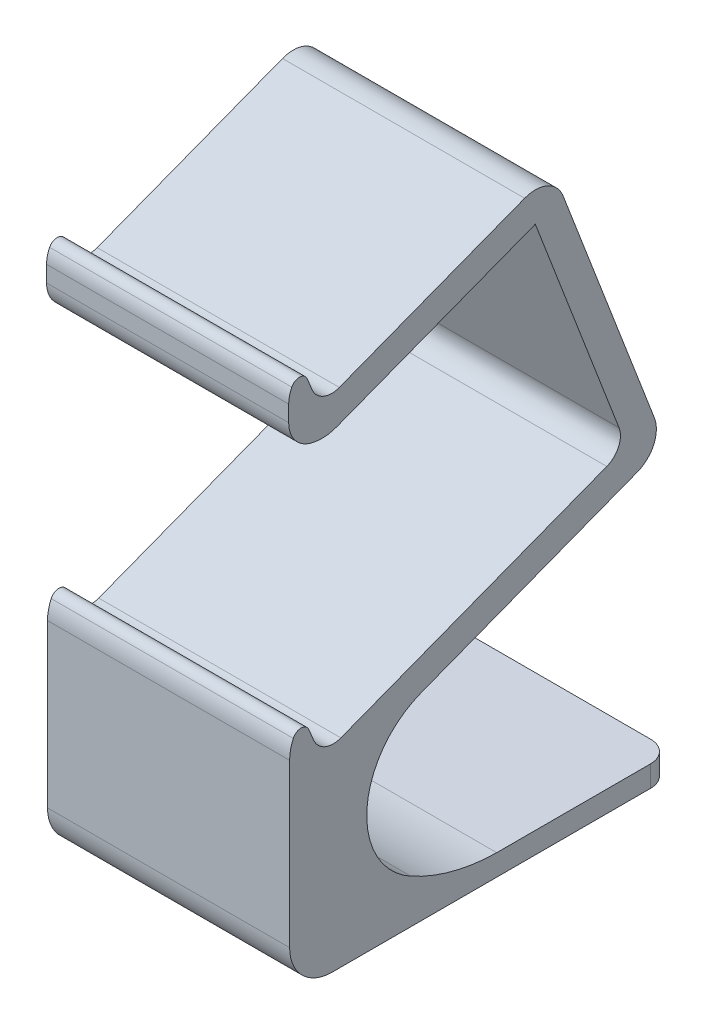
SolidWorks part; units mm, degrees
ref_plane "Front Plane" through (0, 0, 0) normal (0, 0, 1) x (1, 0, 0)
ref_plane "Top Plane" through (0, 0, 0) normal (0, 1, 0) x (1, 0, 0)
ref_plane "Right Plane" through (0, 0, 0) normal (1, 0, 0) x (0, 0, -1)
sketch "Sketch1" plane through (0, 0, 0) normal (0, 1, 0) x (1, 0, 0)
  line L1 (0, 0) -> (57, 0)
  line L2 (0, 0) -> (0, 90)
  line L3 (0, 90) -> (57, 90)
  line L4 (57, 0) -> (57, 90)
  dimension "D1" = 57
  dimension "D2" = 90
extrude "Boss-Extrude1" add sketch "Sketch1" along normal blind 5
sketch "Sketch2" plane through (0, 5, 0) normal (0, 1, 0) x (1, 0, 0)
  line L0 (57, 0) -> (57, 90) construction
  line L1 (0, 0) -> (57, 0)
  line L2 (0, 0) -> (0, 7.5)
  line L3 (0, 7.5) -> (57, 7.5)
  line L4 (57, 0) -> (57, 7.5)
  dimension "D1" = 7.5
extrude "Boss-Extrude2" add sketch "Sketch2" along normal blind 40
sketch "Sketch3" plane through (0, 0, -7.5) normal (0, 0, -1) x (-1, 0, 0)
  line L0 (-57, 45) -> (-57, 5) construction
  line L1 (0, 45) -> (-57, 45)
  line L2 (0, 45) -> (0, 37.5)
  line L3 (0, 37.5) -> (-57, 37.5)
  line L4 (-57, 45) -> (-57, 37.5)
  dimension "D1" = 7.5
extrude "Boss-Extrude3" add sketch "Sketch3" along normal blind 62.5 draft 21
sketch "Sketch4" plane through (0, 0, 0) normal (0, 0, 1) x (1, 0, 0)
  line L0 (31.35, 0) -> (-31.35, 0) construction
  line L1 (0, 0) -> (-29.7862, 0)
  line L2 (0, 0) -> (0, 72.5874)
  line L3 (0, 72.5874) -> (-29.7862, 72.5874)
  line L4 (-29.7862, 0) -> (-29.7862, 72.5874)
  line L5 (57, 0) -> (100.1216, 0)
  line L6 (57, 0) -> (57, 72.5874)
  line L7 (57, 72.5874) -> (100.1216, 72.5874)
  line L8 (100.1216, 0) -> (100.1216, 72.5874)
  line L9 (57, 45) -> (57, 0) construction
extrude "Cut-Extrude1" cut sketch "Sketch4" against normal through all
sketch "Sketch5" plane through (57, 0, 0) normal (1, 0, 0) x (0, 0, -1)
  line L0 (7.5, 37.5) -> (70, 61.4915) construction
  line L1 (70, 68.9915) -> (70, 13.5085) construction
  line L2 (70, 61.4915) -> (70, 68.9915) construction
  line L3 (70, 68.9915) -> (7.5, 45) construction
  line L4 (7.5, 45) -> (7.5, 37.5) construction
  line L5 (7.5, 37.5) -> (70, 13.5085)
  line L6 (70, 13.5085) -> (70, 61.4915)
  line L7 (70, 61.4915) -> (7.5, 37.5)
  dimension "D1" = 7.5
extrude "Cut-Extrude2" cut sketch "Sketch5" against normal through all
fillet "Fillet2" radius 10 1 edges at (28.5, 0, 0)
sketch "Sketch7" plane through (57, 0, 0) normal (1, 0, 0) x (0, 0, -1)
  line L0 (7.5, 45) -> (0, 45)
  line L1 (0, 31.35) -> (0, -31.35) construction
  line L2 (0, 45) -> (7.5, 45) construction
  line L3 (0, 45) -> (0, 55.5032)
  line L4 (0, 55.5032) -> (3.1733, 55.5032)
  line L5 (3.1733, 55.5032) -> (7.5, 45)
extrude "Boss-Extrude4" add sketch "Sketch7" against normal up to surface (57 mm away)
fillet "Fillet3" radius 10 1 edges at (28.5, 55.5032, 0)
fillet "Fillet4" radius 2 1 edges at (28.5, 55.5032, -3.1733)
fillet "Fillet5" radius 5 1 edges at (28.5, 45, -7.5)
sketch "Sketch8" plane through (57, 0, 0) normal (1, 0, 0) x (0, 0, -1)
  line L0 (70, 61.4915) -> (81.845, 66.0384)
  line L1 (85.8726, 75.0844) -> (64.3705, 131.0992)
  line L2 (55.3245, 135.1268) -> (-0.2235, 113.8039)
  line L3 (-0.2235, 113.8039) -> (2.2857, 107.2671)
  line L4 (2.2857, 107.2671) -> (57.8337, 128.59)
  line L5 (57.8337, 128.59) -> (79.3358, 72.5752)
  line L6 (79.3358, 72.5752) -> (70, 68.9915)
  line L7 (70, 68.9915) -> (70, 61.4915)
  line L8 (12.0561, 46.7489) -> (70, 68.9915) construction
  line L9 (70, 61.4915) -> (7.5, 37.5) construction
  arc A0 (81.845, 66.0384) -> (85.8726, 75.0844) centre (79.3358, 72.5752) ccw
  arc A1 (64.3705, 131.0992) -> (55.3245, 135.1268) centre (57.8337, 128.59) ccw
  dimension "D3" = 10
  dimension "D1" = 60
  dimension "D2" = 59.5
  dimension "D4" = 90
extrude "Boss-Extrude5" add sketch "Sketch8" against normal up to surface (57 mm away)
sketch "Sketch10" plane through (0, 0, 0) normal (-1, 0, 0) x (0, 0, 1)
  line L0 (0.2235, 113.8039) -> (0.2235, 126.8039)
  line L1 (0.2235, 126.8039) -> (-2.9565, 126.8039)
  line L3 (-2.9565, 126.8039) -> (-7.1304, 116.6268)
  line L4 (0.2235, 113.8039) -> (-55.3245, 135.1268) construction
  line L5 (-7.1304, 116.6268) -> (0.2235, 113.8039)
  dimension "D1" = 13
  dimension "D2" = 3.18
  dimension "D3" = 112.3
extrude "Boss-Extrude6" add sketch "Sketch10" against normal up to surface (57 mm away)
sketch "Sketch11" plane through (57, 0, 0) normal (1, 0, 0) x (0, 0, -1)
  line L0 (7.5, 5) -> (90, 5) construction
  arc A0 (7.5, 37.5) -> (48.75, 5) centre (49.253, 48.0663) ccw
rib "Rib1" sketch "Sketch11" sketch "Sketch11" thickness 57 extrusion direction parallel to sketch draft on no parameters "D1"=57
fillet "Fillet10" radius 20 1 edges at (28.5, 37.5, -7.5)
fillet "Fillet11" radius 5 2 edges at (0, 2.5, -90) (57, 2.5, -90)
fillet "Fillet12" radius 5 1 edges at (28.5, 72.5752, -79.3358)
fillet "Fillet13" radius 5 1 edges at (28.5, 116.6268, -7.1304)
fillet "Fillet14" radius 10 1 edges at (28.5, 107.2671, -2.2857)
fillet "Fillet15" radius 7 1 edges at (28.5, 113.8039, 0.2235)
fillet "Fillet16" radius 7 1 edges at (28.5, 126.8039, 0.2235)
fillet "Fillet17" radius 2 1 edges at (28.5, 126.8039, -2.9565)
